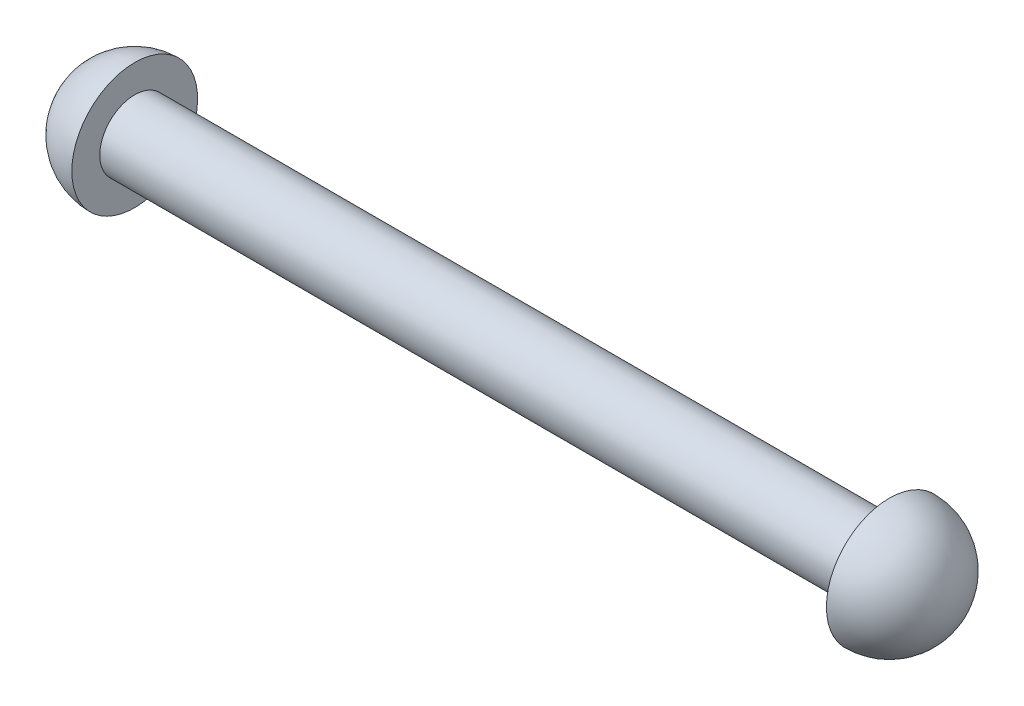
SolidWorks part; units mm, degrees
ref_plane "Front Plane" through (0, 0, 0) normal (0, 0, 1) x (1, 0, 0)
ref_plane "Top Plane" through (0, 0, 0) normal (0, 1, 0) x (1, 0, 0)
ref_plane "Right Plane" through (0, 0, 0) normal (1, 0, 0) x (0, 0, -1)
sketch "Sketch1" plane through (0, 0, 0) normal (0, 0, 1) x (1, 0, 0)
  line L0 (34.29, 0) -> (-34.29, 0)
  line L1 (-34.29, 0) -> (-34.29, 2.54)
  line L2 (-40.005, -3.175) -> (40.005, -3.175)
  line L3 (0, -3.175) -> (0, 13.5467) construction
  line L4 (34.29, 0) -> (34.29, 2.54)
  arc A0 (-34.29, 2.54) -> (-40.005, -3.175) centre (-34.29, -3.175) ccw
  arc A1 (34.29, 2.54) -> (40.005, -3.175) centre (34.29, -3.175) cw
  point P12 (0, 0)
  dimension "D1" = 5.715
  dimension "D2" = 34.29
  dimension "D3" = 3.175
revolve "Revolve1" add sketch "Sketch1" angle 360 about L2
